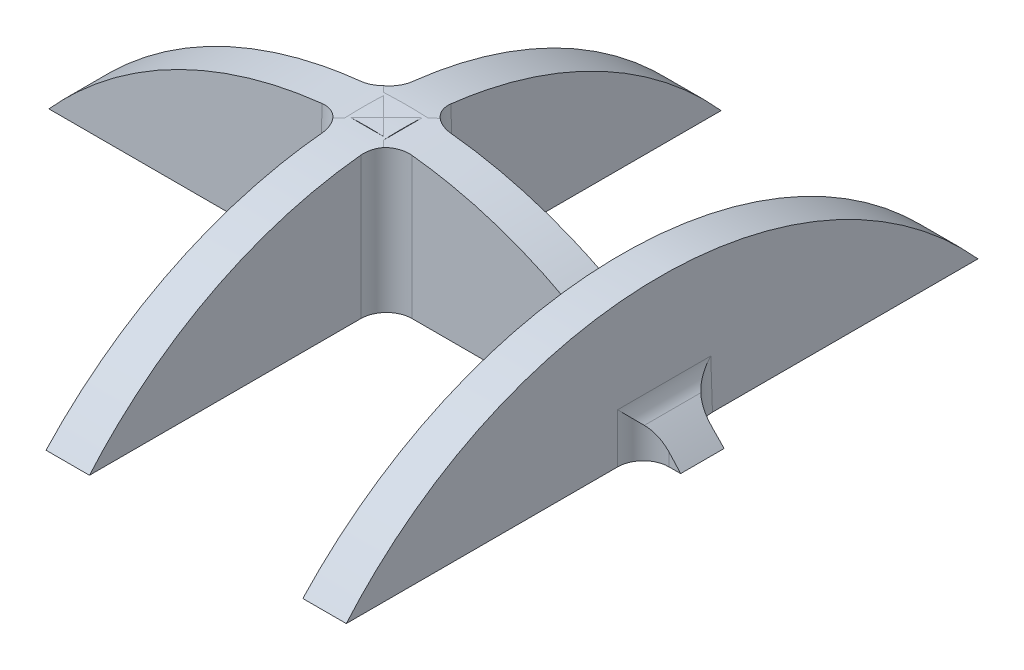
SolidWorks part; units mm, degrees
ref_plane "Vorderansicht" through (0, 0, 0) normal (0, 0, 1) x (1, 0, 0)
ref_plane "Draufsicht" through (0, 0, 0) normal (0, 1, 0) x (1, 0, 0)
ref_plane "Seitenansicht" through (0, 0, 0) normal (1, 0, 0) x (0, 0, -1)
other "Join1"
other "Part1-Rippe<1>@Assem1-Rippen"
other "Part1-Rippe<2>@Assem1-Rippen"
other "Part1-Rippe<3>@Assem1-Rippen"
fillet "Fillet1" radius 2 15 edges at (-4.1065, 32.7435, -1.5045) (21.6666, 23.4565, -1.6666) (18.3551, 24.6964, -1.6449) (1.5964, 27.4774, -1.5964) (-1.5964, 27.4774, -1.5964) (10.3341, 31.3402, 1.529) (-14.1538, 29.8106, 1.5557) (21.6666, 23.4565, 1.6666) (18.3551, 24.6964, 1.6449) (1.5963, 27.4829, 1.5963) (-1.5963, 27.4829, 1.5963) (21.6412, 24.9131, 0) (18.4021, 27.3927, 0) (-1.5565, 29.7617, -14.0298) (1.5565, 29.7617, -14.0298)
